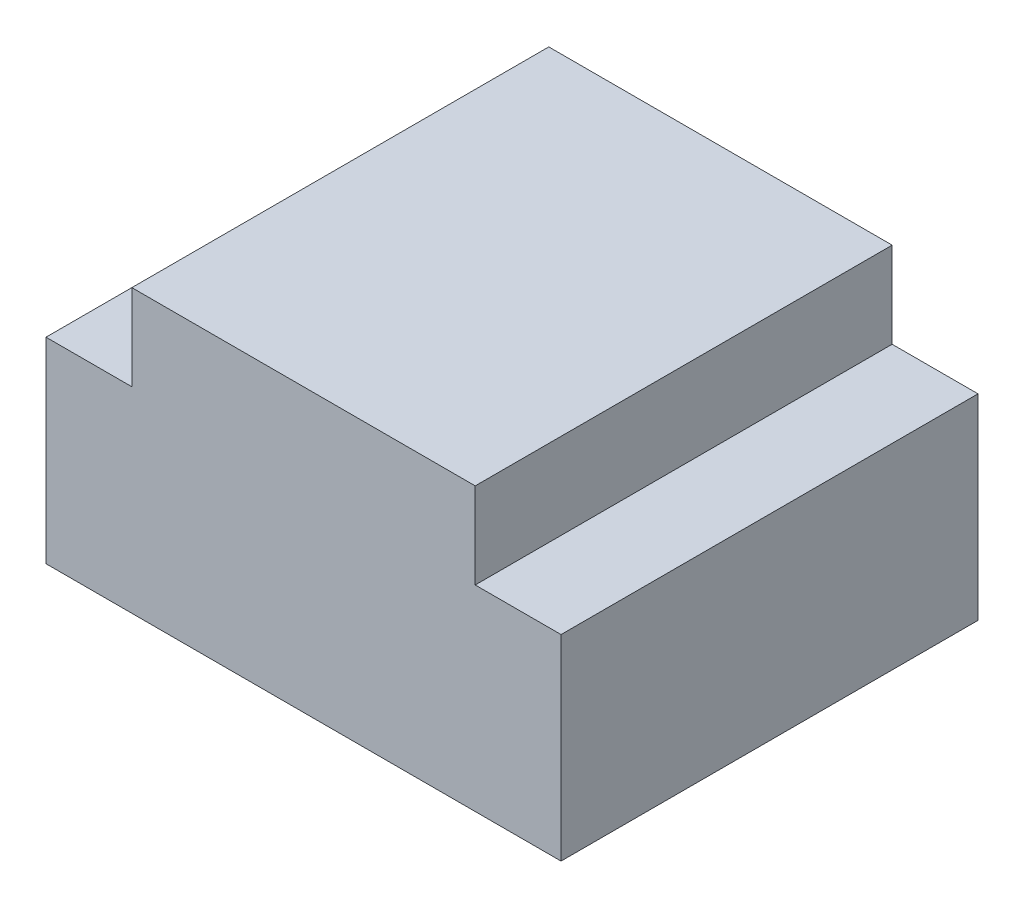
SolidWorks part; units mm, degrees
ref_plane "Plan de face" through (0, 0, 0) normal (0, 0, 1) x (1, 0, 0)
ref_plane "Plan de dessus" through (0, 0, 0) normal (0, 1, 0) x (1, 0, 0)
ref_plane "Plan de droite" through (0, 0, 0) normal (1, 0, 0) x (0, 0, -1)
sketch "Esquisse1" plane through (0, 0, 0) normal (0, 1, 0) x (1, 0, 0)
  line L1 (-35.6336, 25.1055) -> (6.3664, 25.1055)
  line L2 (-35.6336, 25.1055) -> (-35.6336, -8.8945)
  line L3 (-35.6336, -8.8945) -> (6.3664, -8.8945)
  line L4 (6.3664, 25.1055) -> (6.3664, -8.8945)
  dimension "D1" = 42
  dimension "D2" = 34
extrude "Extrusion1" add sketch "Esquisse1" along normal blind 16
sketch "Esquisse2" plane through (0, 16, 0) normal (0, 1, 0) x (-1, 0, 0)
  line L0 (28.6336, -25.1055) -> (28.6336, 8.8945)
  line L1 (-6.3664, -25.1055) -> (35.6336, -25.1055) construction
  line L2 (35.6336, 8.8945) -> (-6.3664, 8.8945) construction
  line L3 (28.6336, 8.8945) -> (0.6336, 8.8945)
  line L4 (0.6336, 8.8945) -> (0.6336, -25.1055)
  line L5 (0.6336, -25.1055) -> (28.6336, -25.1055)
  line L6 (-6.3664, 8.8945) -> (-6.3664, -25.1055) construction
  dimension "D1" = 28
  dimension "D2" = 7
extrude "Extrusion2" add sketch "Esquisse2" along normal blind 7
sketch "Esquisse3" plane through (0, 0, 0) normal (0, -1, 0) x (1, 0, 0)
  line L0 (-28.6336, 1.8945) -> (-0.6336, 1.8945)
  line L1 (-0.6336, 1.8945) -> (-0.6336, -18.1055)
  line L2 (-0.6336, -18.1055) -> (-28.6336, -18.1055)
  line L3 (-28.6336, -18.1055) -> (-28.6336, 1.8945)
  line L4 (6.3664, 8.8945) -> (6.3664, -25.1055) construction
  line L5 (6.3664, -25.1055) -> (-35.6336, -25.1055) construction
  dimension "D1" = 28
  dimension "D2" = 20
  dimension "D3" = 7
  dimension "D4" = 7
extrude "Extrusion3" add sketch "Esquisse3" along normal blind 6.5
